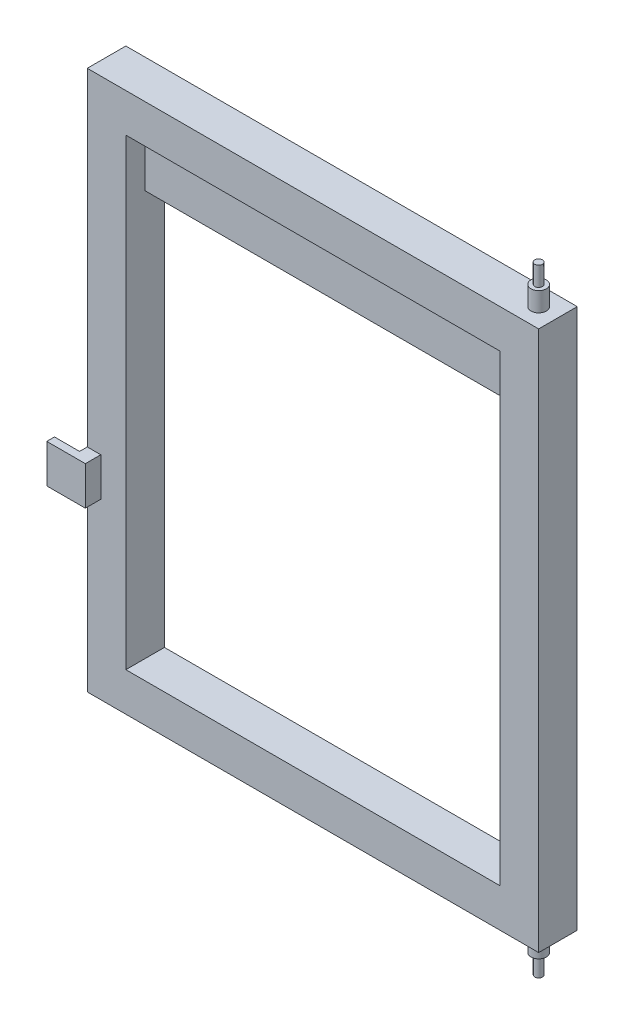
SolidWorks part; units mm, degrees
ref_plane "Face" through (0, 0, 0) normal (0, 0, 1) x (1, 0, 0)
ref_plane "Dessus" through (0, 0, 0) normal (0, 1, 0) x (1, 0, 0)
ref_plane "Droite" through (0, 0, 0) normal (1, 0, 0) x (0, 0, -1)
sketch "Esquisse1" plane through (0, 0, 0) normal (0, 0, 1) x (1, 0, 0)
  line L0 (-292.5, -350) -> (292.5, 350) construction
  line L1 (242.5, 300) -> (-242.5, 300)
  line L2 (292.5, 350) -> (-292.5, 350)
  line L3 (292.5, 350) -> (292.5, -350)
  line L4 (292.5, -350) -> (-292.5, -350)
  line L5 (-292.5, 350) -> (-292.5, -350)
  line L6 (-242.5, 300) -> (-242.5, -300)
  line L7 (242.5, -300) -> (-242.5, -300)
  line L8 (242.5, 300) -> (242.5, -300)
  dimension "D1" = 700
  dimension "D2" = 585
  dimension "D3" = 50
extrude "Base-Extrusion" add sketch "Esquisse1" along normal mid plane 50
sketch "Esquisse3" plane through (0, 0, 0) normal (0, 1, 0) x (1, 0, 0)
  line L0 (0, 0) -> (267.5, 0) construction
  line L2 (292.5, -25) -> (292.5, 25) construction
  circle A0 centre (267.5, 0) radius 5
  dimension "D2" = 10
  dimension "D1" = 25
extrude "Boss.-Extru.2" add sketch "Esquisse3" along normal mid plane 800
sketch "Esquisse2" plane through (0, 0, 0) normal (0, 0, 1) x (1, 0, 0)
  line L0 (242.5, -300) -> (242.5, 300) construction
  line L1 (-242.5, 300) -> (242.5, 300)
  line L2 (-242.5, 300) -> (-242.5, 225)
  line L3 (-242.5, 225) -> (242.5, 225)
  line L4 (242.5, 300) -> (242.5, 225)
  dimension "D1" = 75
extrude "Boss.-Extru.1" add sketch "Esquisse2" against normal blind 25
ref_plane "Plan1" through (0, -100, 0) normal (0, -1, 0) x (1, 0, 0)
sketch "Esquisse4" plane through (0, -100, 0) normal (0, -1, 0) x (1, 0, 0)
  line L1 (-292.5, 25) -> (-275, 25)
  line L2 (-325, 35) -> (-325, 45)
  line L3 (-325, 45) -> (-275, 45)
  line L4 (-275, 25) -> (-275, 45)
  line L5 (-292.5, 25) -> (-292.5, -25) construction
  line L6 (292.5, 25) -> (-292.5, 25) construction
  line L7 (-325, 35) -> (-292.5, 35)
  line L8 (-292.5, 25) -> (-292.5, 35)
  dimension "D1" = 10
  dimension "D2" = 32.5
  dimension "D3" = 50
extrude "Boss.-Extru.3" add sketch "Esquisse4" against normal mid plane 50
sketch "Esquisse5" plane through (0, 0, 0) normal (0, 1, 0) x (1, 0, 0)
  circle A0 centre (267.5, 0) radius 10
  dimension "D1" = 20
extrude "Boss.-Extru.4" add sketch "Esquisse5" along normal mid plane 750
